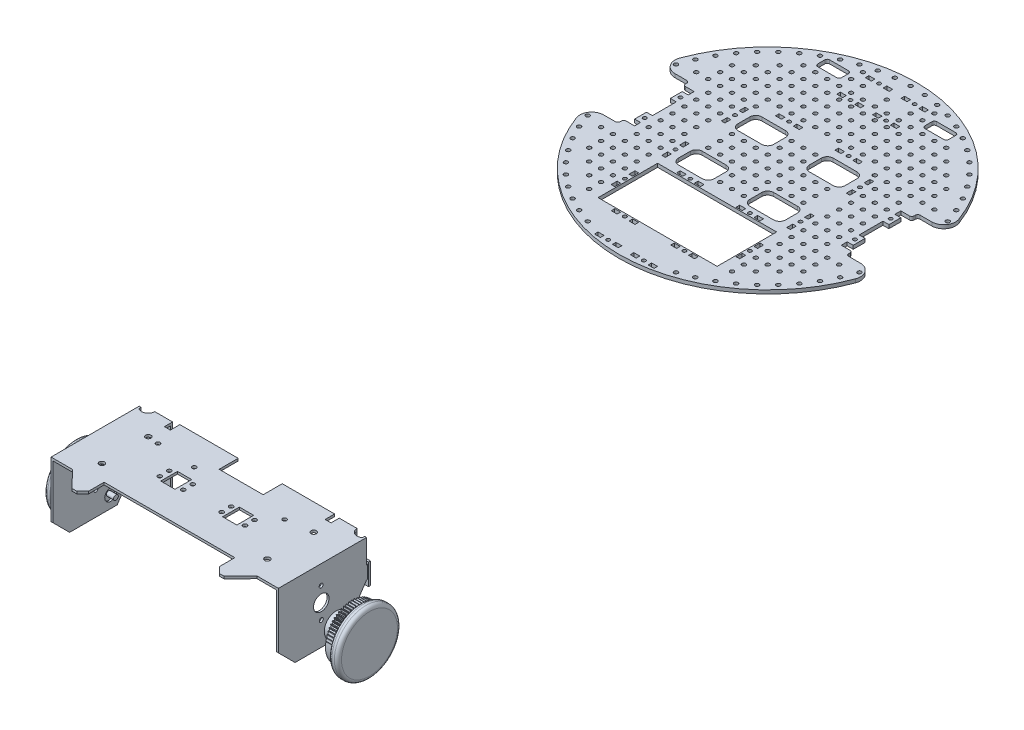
SolidWorks part; units mm, degrees
other "<Chassis_Cachan_Coupe_2019>-<Bloc_moteur_assemble-1/Chassis_Cachan-1-solid1>"
other "<Chassis_Cachan_Coupe_2019>-<Assemblage_roue-1/Roue-1-solid1>"
other "<Chassis_Cachan_Coupe_2019>-<Assemblage_roue-1/spur gear_iso-1-solid1>"
other "<Chassis_Cachan_Coupe_2019>-<Assemblage_roue-2/Roue-1-solid1>"
other "<Chassis_Cachan_Coupe_2019>-<Assemblage_roue-2/spur gear_iso-1-solid1>"
ref_plane "Plan de face" through (0, 0, 0) normal (0, 0, 1) x (1, 0, 0)
ref_plane "Plan de dessus" through (0, 0, 0) normal (0, 1, 0) x (1, 0, 0)
ref_plane "Plan de droite" through (0, 0, 0) normal (1, 0, 0) x (0, 0, -1)
inserted part "Chassis_Cachan_Coupe_2019"
sketch "Esquisse1" plane through (0, 7.9464, 0) normal (0, 1, 0) x (1, 0, 0)
  line L0 (-90, 0) -> (90, 0) construction
  line L1 (-96, -30) -> (-113.0885, -30)
  line L2 (-51, 41.5) -> (58.6644, 41.5) construction
  line L4 (-96, -25) -> (-96, -30)
  line L5 (88.3, 10) -> (88.3, 20) construction
  line L6 (86.8, -10) -> (91.8, -10)
  line L7 (86.8, 10) -> (86.8, 5)
  line L8 (-89.8, -25) -> (-96, -25)
  line L9 (91.8, -10) -> (91.8, -20)
  line L10 (86.8, 5) -> (89.8, 5) construction
  line L11 (86.8, 20) -> (86.8, 25)
  line L12 (-86.8, -25) -> (-89.8, -25)
  line L13 (91.8, -20) -> (86.8, -20)
  line L14 (-86.8, -20) -> (-86.8, -25)
  line L15 (88.3, 15) -> (81.3276, 15) construction
  line L16 (88.3, -20) -> (88.3, -10) construction
  line L17 (86.8, -20) -> (86.8, -25)
  line L18 (-91.8, -20) -> (-86.8, -20)
  line L19 (-91.8, -10) -> (-91.8, -20)
  line L20 (86.8, -25) -> (89.8, -25)
  line L21 (86.8, -10) -> (86.8, -5)
  line L22 (-86.8, -10) -> (-91.8, -10)
  line L23 (89.8, -25) -> (96, -25)
  line L24 (86.8, -5) -> (89.8, -5) construction
  line L25 (88.3, -15) -> (81.3276, -15) construction
  line L26 (96, -25) -> (96, -30)
  line L27 (86.8, 10) -> (91.8, 10)
  line L28 (91.8, 10) -> (91.8, 20)
  line L29 (91.8, 20) -> (86.8, 20)
  line L30 (96, 30) -> (113.0885, 30)
  line L31 (96, 30) -> (96, -30) construction
  line L32 (96, -30) -> (113.0885, -30)
  line L33 (113.0885, 30) -> (113.0885, -30) construction
  line L34 (-86.8, -10) -> (-86.8, -5)
  line L35 (-86.8, -5) -> (-86.8, 5)
  line L36 (-86.8, 10) -> (-86.8, 5)
  line L37 (-86.8, 10) -> (-91.8, 10)
  line L38 (86.8, 25) -> (96, 25)
  line L39 (86.8, -5) -> (86.8, 5)
  line L40 (96, 25) -> (96, 30)
  line L41 (-91.8, 10) -> (-91.8, 20)
  line L42 (-91.8, 20) -> (-86.8, 20)
  line L43 (-86.8, 20) -> (-86.8, 25)
  line L44 (-86.8, 25) -> (-96, 25)
  line L45 (-96, 25) -> (-96, 30)
  line L46 (-96, 30) -> (-113.0885, 30)
  line L59 (0, 0) -> (0, -125) construction
  line L82 (0, -93.5) -> (0, -41.5) construction
  line L83 (-51, -93.5) -> (51, -93.5) construction
  line L84 (-51, -93.5) -> (-51, -41.5) construction
  line L85 (-51, -41.5) -> (51, -41.5) construction
  line L86 (51, -93.5) -> (51, -41.5) construction
  line L87 (-51, -67.5) -> (51, -67.5) construction
  line L91 (-44.985, -93.5) -> (-35.015, -93.5) construction
  line L94 (-24.985, -93.5) -> (-15.015, -93.5) construction
  line L98 (-4.985, -93.5) -> (4.985, -93.5) construction
  line L102 (15.015, -93.5) -> (24.985, -93.5) construction
  line L106 (35.015, -93.5) -> (44.985, -93.5) construction
  line L108 (-51, -41.5) -> (51, -41.5) construction
  line L110 (35.015, -41.5) -> (44.985, -41.5) construction
  line L114 (15.015, -41.5) -> (24.985, -41.5) construction
  line L118 (-4.985, -41.5) -> (4.985, -41.5) construction
  line L122 (-24.985, -41.5) -> (-15.015, -41.5) construction
  line L125 (-44.985, -41.5) -> (-35.015, -41.5) construction
  line L129 (51, -93.5) -> (51, -41.5) construction
  line L131 (-51, -93.485) -> (-51, -83.515) construction
  line L135 (-51, -73.485) -> (-51, -63.515) construction
  line L139 (-51, -53.485) -> (-51, -43.515) construction
  line L144 (51, -53.485) -> (51, -43.515) construction
  line L148 (51, -73.485) -> (51, -63.515) construction
  line L152 (51, -93.485) -> (51, -83.515) construction
  line L154 (-51, -93.485) -> (-51, -93.5) construction
  line L155 (-51, -93.5) -> (-44.985, -93.5) construction
  line L156 (-35.015, -93.5) -> (-24.985, -93.5) construction
  line L157 (-15.015, -93.5) -> (-4.985, -93.5) construction
  line L158 (4.985, -93.5) -> (15.015, -93.5) construction
  line L159 (24.985, -93.5) -> (35.015, -93.5) construction
  line L160 (44.985, -93.5) -> (51, -93.5) construction
  line L161 (51, -93.5) -> (51, -93.485) construction
  line L162 (51, -83.515) -> (51, -73.485) construction
  line L163 (51, -63.515) -> (51, -53.485) construction
  line L164 (51, -43.515) -> (51, -41.5) construction
  line L165 (51, -41.5) -> (44.985, -41.5) construction
  line L166 (35.015, -41.5) -> (24.985, -41.5) construction
  line L167 (15.015, -41.5) -> (4.985, -41.5) construction
  line L168 (-4.985, -41.5) -> (-15.015, -41.5) construction
  line L169 (-24.985, -41.5) -> (-35.015, -41.5) construction
  line L170 (-44.985, -41.5) -> (-51, -41.5) construction
  line L171 (-51, -41.5) -> (-51, -43.515) construction
  line L172 (-51, -53.485) -> (-51, -63.515) construction
  line L173 (-51, -73.485) -> (-51, -83.515) construction
  line L174 (125.9773, 20) -> (118.7192, 20) construction
  line L181 (-27.8375, -117.5) -> (13.4826, -117.5) construction
  line L190 (-20, -96.2) -> (-20, -145.4677) construction
  line L191 (-40, -96.2) -> (-40, -138) construction
  line L253 (-50.9895, 107) -> (24.0329, 107) construction
  line L262 (-38.4384, 83) -> (36.5098, 83) construction
  circle A0 centre (0, 0) radius 125
  circle A1 centre (88.3, 15) radius 1.5
  circle A2 centre (88.3, -15) radius 1.5
  circle A3 centre (-88.3, -15) radius 1.5
  circle A4 centre (-88.3, 15) radius 1.5
  arc A5 (-113.0885, -30) -> (-113.0885, 30) centre (0, 0) cw
  arc A32 (113.0885, -30) -> (113.0885, 30) centre (0, 0) ccw
  point P115 (86.8, 0)
  line B0 (-54, 20) -> (-54, 15)
  line B1 (-54, 20) -> (-51, 20)
  line B2 (-51, 20) -> (-51, 15)
  line B3 (-54, 15) -> (-51, 15)
  line B4 (-54, 30) -> (-54, 35)
  line B5 (-54, 30) -> (-51, 30)
  line B6 (-51, 30) -> (-51, 35)
  line B7 (-54, 35) -> (-51, 35)
  line B8 (-52.5, 25) -> (-59.4724, 25) construction
  circle B9 centre (-52.5, 25) radius 1.5
  line B10 (-54, -30) -> (-54, -35)
  line B11 (-54, -30) -> (-51, -30)
  line B12 (-51, -30) -> (-51, -35)
  line B13 (-54, -35) -> (-51, -35)
  line B14 (-54, -20) -> (-54, -15)
  line B15 (-54, -20) -> (-51, -20)
  line B16 (-51, -20) -> (-51, -15)
  line B17 (-54, -15) -> (-51, -15)
  line B18 (-52.5, -25) -> (-59.4724, -25) construction
  circle B19 centre (-52.5, -25) radius 1.5
  line B20 (54, 30) -> (54, 35)
  line B21 (54, 30) -> (51, 30)
  line B22 (51, 30) -> (51, 35)
  line B23 (54, 35) -> (51, 35)
  line B24 (54, 20) -> (54, 15)
  line B25 (54, 20) -> (51, 20)
  line B26 (51, 20) -> (51, 15)
  line B27 (54, 15) -> (51, 15)
  line B28 (52.5, 25) -> (59.4724, 25) construction
  circle B29 centre (52.5, 25) radius 1.5
  line B30 (54, -20) -> (54, -15)
  line B31 (54, -20) -> (51, -20)
  line B32 (51, -20) -> (51, -15)
  line B33 (54, -15) -> (51, -15)
  line B34 (54, -30) -> (54, -35)
  line B35 (54, -30) -> (51, -30)
  line B36 (51, -30) -> (51, -35)
  line B37 (54, -35) -> (51, -35)
  line B38 (52.5, -25) -> (59.4724, -25) construction
  circle B39 centre (52.5, -25) radius 1.5
  line B40 (-30, 44.5) -> (-35, 44.5)
  line B41 (-30, 44.5) -> (-30, 41.5)
  line B42 (-30, 41.5) -> (-35, 41.5)
  line B43 (-35, 44.5) -> (-35, 41.5)
  line B44 (-20, 44.5) -> (-15, 44.5)
  line B45 (-20, 44.5) -> (-20, 41.5)
  line B46 (-20, 41.5) -> (-15, 41.5)
  line B47 (-15, 44.5) -> (-15, 41.5)
  line B48 (-25, 43) -> (-25, 49.9724) construction
  circle B49 centre (-25, 43) radius 1.5
  line B50 (20, 44.5) -> (15, 44.5)
  line B51 (20, 44.5) -> (20, 41.5)
  line B52 (20, 41.5) -> (15, 41.5)
  line B53 (15, 44.5) -> (15, 41.5)
  line B54 (30, 44.5) -> (35, 44.5)
  line B55 (30, 44.5) -> (30, 41.5)
  line B56 (30, 41.5) -> (35, 41.5)
  line B57 (35, 44.5) -> (35, 41.5)
  line B58 (25, 43) -> (25, 49.9724) construction
  circle B59 centre (25, 43) radius 1.5
  line B60 (-54, -72.5) -> (-54, -77.5)
  line B61 (-54, -72.5) -> (-51, -72.5)
  line B62 (-51, -72.5) -> (-51, -77.5)
  line B63 (-54, -77.5) -> (-51, -77.5)
  line B64 (-54, -62.5) -> (-54, -57.5)
  line B65 (-54, -62.5) -> (-51, -62.5)
  line B66 (-51, -62.5) -> (-51, -57.5)
  line B67 (-54, -57.5) -> (-51, -57.5)
  line B68 (-52.5, -67.5) -> (-59.4724, -67.5) construction
  circle B69 centre (-52.5, -67.5) radius 1.5
  line B70 (20, -38.5) -> (15, -38.5)
  line B71 (20, -38.5) -> (20, -41.5)
  line B72 (20, -41.5) -> (15, -41.5)
  line B73 (15, -38.5) -> (15, -41.5)
  line B74 (30, -38.5) -> (35, -38.5)
  line B75 (30, -38.5) -> (30, -41.5)
  line B76 (30, -41.5) -> (35, -41.5)
  line B77 (35, -38.5) -> (35, -41.5)
  line B78 (25, -40) -> (25, -33.0276) construction
  circle B79 centre (25, -40) radius 1.5
  line B80 (-30, -38.5) -> (-35, -38.5)
  line B81 (-30, -38.5) -> (-30, -41.5)
  line B82 (-30, -41.5) -> (-35, -41.5)
  line B83 (-35, -38.5) -> (-35, -41.5)
  line B84 (-20, -38.5) -> (-15, -38.5)
  line B85 (-20, -38.5) -> (-20, -41.5)
  line B86 (-20, -41.5) -> (-15, -41.5)
  line B87 (-15, -38.5) -> (-15, -41.5)
  circle B88 centre (-25, -40) radius 1.5
  line B89 (-30, -93.5) -> (-35, -93.5)
  line B90 (-30, -93.5) -> (-30, -96.5)
  line B91 (-30, -96.5) -> (-35, -96.5)
  line B92 (-35, -93.5) -> (-35, -96.5)
  line B93 (-20, -93.5) -> (-15, -93.5)
  line B94 (-20, -93.5) -> (-20, -96.5)
  line B95 (-20, -96.5) -> (-15, -96.5)
  line B96 (-15, -93.5) -> (-15, -96.5)
  circle B97 centre (-25, -95) radius 1.5
  line B98 (20, -93.5) -> (15, -93.5)
  line B99 (20, -93.5) -> (20, -96.5)
  line B100 (20, -96.5) -> (15, -96.5)
  line B101 (15, -93.5) -> (15, -96.5)
  line B102 (30, -93.5) -> (35, -93.5)
  line B103 (30, -93.5) -> (30, -96.5)
  line B104 (30, -96.5) -> (35, -96.5)
  line B105 (35, -93.5) -> (35, -96.5)
  line B106 (25, -95) -> (25, -88.0276) construction
  circle B107 centre (25, -95) radius 1.5
  line B108 (54, -62.5) -> (54, -57.5)
  line B109 (54, -62.5) -> (51, -62.5)
  line B110 (51, -62.5) -> (51, -57.5)
  line B111 (54, -57.5) -> (51, -57.5)
  line B112 (54, -72.5) -> (54, -77.5)
  line B113 (54, -72.5) -> (51, -72.5)
  line B114 (51, -72.5) -> (51, -77.5)
  line B115 (54, -77.5) -> (51, -77.5)
  line B116 (52.5, -67.5) -> (59.4724, -67.5) construction
  circle B117 centre (52.5, -67.5) radius 1.5
  line B118 (10, -117.5) -> (5, -117.5)
  line B119 (10, -117.5) -> (10, -120.5)
  line B120 (10, -120.5) -> (5, -120.5)
  line B121 (5, -117.5) -> (5, -120.5)
  line B122 (20, -117.5) -> (25, -117.5)
  line B123 (20, -117.5) -> (20, -120.5)
  line B124 (20, -120.5) -> (25, -120.5)
  line B125 (25, -117.5) -> (25, -120.5)
  line B126 (15, -119) -> (15, -112.0276) construction
  circle B127 centre (15, -119) radius 1.5
  line B128 (-20, -117.5) -> (-25, -117.5)
  line B129 (-20, -117.5) -> (-20, -120.5)
  line B130 (-20, -120.5) -> (-25, -120.5)
  line B131 (-25, -117.5) -> (-25, -120.5)
  line B132 (-10, -117.5) -> (-5, -117.5)
  line B133 (-10, -117.5) -> (-10, -120.5)
  line B134 (-10, -120.5) -> (-5, -120.5)
  line B135 (-5, -117.5) -> (-5, -120.5)
  line B136 (-15, -119) -> (-15, -112.0276) construction
  circle B137 centre (-15, -119) radius 1.5
  line B138 (-20, 86) -> (-25, 86)
  line B139 (-20, 86) -> (-20, 83)
  line B140 (-20, 83) -> (-25, 83)
  line B141 (-25, 86) -> (-25, 83)
  line B142 (-10, 86) -> (-5, 86)
  line B143 (-10, 86) -> (-10, 83)
  line B144 (-10, 83) -> (-5, 83)
  line B145 (-5, 86) -> (-5, 83)
  line B146 (-15, 84.5) -> (-15, 91.4724) construction
  circle B147 centre (-15, 84.5) radius 1.5
  line B148 (10, 86) -> (5, 86)
  line B149 (10, 86) -> (10, 83)
  line B150 (10, 83) -> (5, 83)
  line B151 (5, 86) -> (5, 83)
  line B152 (20, 86) -> (25, 86)
  line B153 (20, 86) -> (20, 83)
  line B154 (20, 83) -> (25, 83)
  line B155 (25, 86) -> (25, 83)
  line B156 (15, 84.5) -> (15, 91.4724) construction
  circle B157 centre (15, 84.5) radius 1.5
  line B158 (10, 110) -> (5, 110)
  line B159 (10, 110) -> (10, 107)
  line B160 (10, 107) -> (5, 107)
  line B161 (5, 110) -> (5, 107)
  line B162 (20, 110) -> (25, 110)
  line B163 (20, 110) -> (20, 107)
  line B164 (20, 107) -> (25, 107)
  line B165 (25, 110) -> (25, 107)
  line B166 (15, 108.5) -> (15, 115.4724) construction
  circle B167 centre (15, 108.5) radius 1.5
  line B168 (-20, 110) -> (-25, 110)
  line B169 (-20, 110) -> (-20, 107)
  line B170 (-20, 107) -> (-25, 107)
  line B171 (-25, 110) -> (-25, 107)
  line B172 (-10, 110) -> (-5, 110)
  line B173 (-10, 110) -> (-10, 107)
  line B174 (-10, 107) -> (-5, 107)
  line B175 (-5, 110) -> (-5, 107)
  line B176 (-15, 108.5) -> (-15, 115.4724) construction
  circle B177 centre (-15, 108.5) radius 1.5
  dimension "D4" = 96
  dimension "D8" = 8
  dimension "D21" = 250
  dimension "D5" = 60
  dimension "D23" = 3
  dimension "D28" = 3
  dimension "D6" = 80
  dimension "D7" = 15
  dimension "D9" = 26
  dimension "D10" = 15
  dimension "D11" = 9.2
  dimension "D13" = 10
  dimension "D12" = 20
  dimension "D14" = 102
  dimension "D15" = 52
  dimension "D16" = 10
  dimension "D17" = 50
  dimension "D18" = 15
  dimension "D19" = 5
  dimension "D20" = 20
  dimension "D22" = 3
  dimension "D24" = 24
  dimension "D25" = 5
  dimension "D26" = 1.5
  dimension "D27" = 3
  dimension "D29" = 20
  dimension "D30" = 1.5
  dimension "D31" = 5
  dimension "D32" = 83
  dimension "D33" = 30
  dimension "D34" = 5
  dimension "D35" = 24
  dimension "D36" = 30
  dimension "D37" = 25
  dimension "D38" = 30
  dimension "D39" = 25
sketch_block_instance "Insert M3 avec plot 3mm coté trou-1"
sketch_block "Insert M3 avec plot 3mm coté trou" parameters "D2"=3, "D1"=3, "D3"=5, "D4"=10
sketch_block_instance "Insert M3 avec plot 3mm coté trou-2"
sketch_block_instance "Insert M3 avec plot 3mm coté trou-4"
sketch_block_instance "Insert M3 avec plot 3mm coté trou-5"
sketch_block_instance "Insert M3 avec plot 3mm coté trou-10"
sketch_block_instance "Insert M3 avec plot 3mm coté trou-11"
sketch_block_instance "Insert M3 avec plot 3mm coté trou-15"
sketch_block_instance "Insert M3 avec plot 3mm coté trou-18"
sketch_block_instance "Insert M3 avec plot 3mm coté trou-20"
sketch_block_instance "Insert M3 avec plot 3mm coté trou-21"
sketch_block_instance "Insert M3 avec plot 3mm coté trou-23"
sketch_block_instance "Insert M3 avec plot 3mm coté trou-27"
sketch_block_instance "Insert M3 avec plot 3mm coté trou-29"
sketch_block_instance "Insert M3 avec plot 3mm coté trou-30"
sketch_block_instance "Insert M3 avec plot 3mm coté trou-31"
sketch_block_instance "Insert M3 avec plot 3mm coté trou-32"
sketch_block_instance "Insert M3 avec plot 3mm coté trou-33"
sketch_block_instance "Insert M3 avec plot 3mm coté trou-34"
extrude "Boss.-Extru.1" add sketch "Esquisse1" along normal blind 3 separate body
sketch "Esquisse2" plane through (0, 10.9464, 0) normal (0, 1, 0) x (1, 0, 0)
  line L0 (-125, 0) -> (125, 0) construction
  line L1 (0, -125) -> (0, 125) construction
  line L2 (-45, -35) -> (-45, -15)
  line L3 (-45, 35) -> (-15, 35)
  line L6 (-50, -42.5) -> (50, -42.5)
  line L7 (-50, -42.5) -> (-50, -92.5)
  line L8 (-50, -92.5) -> (50, -92.5)
  line L10 (50, -42.5) -> (50, -92.5)
  line L14 (-45, 35) -> (-45, 15)
  line L15 (-45, 15) -> (-15, 15)
  line L16 (-15, 35) -> (-15, 15)
  line L17 (-45, -15) -> (-15, -15)
  line L18 (-15, -35) -> (-15, -15)
  line L19 (-45, -35) -> (-15, -35)
  line L20 (45, -35) -> (45, -15)
  line L21 (45, -35) -> (15, -35)
  line L22 (15, -35) -> (15, -15)
  line L23 (45, -15) -> (15, -15)
  line L24 (45, 35) -> (45, 15)
  line L25 (45, 15) -> (15, 15)
  line L26 (15, 35) -> (15, 15)
  line L27 (45, 35) -> (15, 35)
  line L28 (55, 105) -> (55, 95)
  line L29 (-55, 105) -> (-35, 105)
  line L30 (-55, 105) -> (-55, 95)
  line L31 (-55, 95) -> (-35, 95)
  line L32 (-35, 105) -> (-35, 95)
  line L33 (55, 95) -> (35, 95)
  line L34 (35, 105) -> (35, 95)
  line L35 (55, 105) -> (35, 105)
  line L36 (-20, -41.5) -> (-15, -41.5) construction
  line L38 (51, -57.5) -> (51, -62.5) construction
  line L39 (35, -93.5) -> (30, -93.5) construction
  line L40 (-51, -77.5) -> (-51, -72.5) construction
  circle A0 centre (0, 0) radius 1.65
  circle A2 centre (10, 0) radius 1.65
  circle A3 centre (20, 0) radius 1.65
  circle A4 centre (30, 0) radius 1.65
  circle A5 centre (40, 0) radius 1.65
  circle A6 centre (50, 0) radius 1.65 construction
  circle A7 centre (60, 0) radius 1.65
  circle A8 centre (70, 0) radius 1.65
  circle A9 centre (80, 0) radius 1.65
  circle A10 centre (90, 0) radius 1.65 construction
  circle A11 centre (100, 0) radius 1.65 construction
  circle A12 centre (110, 0) radius 1.65 construction
  circle A13 centre (120, 0) radius 1.65 construction
  circle A14 centre (10, 10) radius 1.65
  circle A15 centre (20, 10) radius 1.65
  circle A16 centre (30, 10) radius 1.65
  circle A17 centre (40, 10) radius 1.65
  circle A18 centre (50, 10) radius 1.65 construction
  circle A19 centre (60, 10) radius 1.65
  circle A20 centre (70, 10) radius 1.65
  circle A21 centre (80, 10) radius 1.65
  circle A22 centre (90, 10) radius 1.65 construction
  circle A23 centre (100, 10) radius 1.65 construction
  circle A24 centre (110, 10) radius 1.65 construction
  circle A25 centre (120, 10) radius 1.65 construction
  circle A26 centre (10, 20) radius 1.65
  circle A27 centre (20, 20) radius 1.65 construction
  circle A28 centre (30, 20) radius 1.65 construction
  circle A29 centre (40, 20) radius 1.65 construction
  circle A30 centre (50, 20) radius 1.65 construction
  circle A31 centre (60, 20) radius 1.65
  circle A32 centre (70, 20) radius 1.65
  circle A33 centre (80, 20) radius 1.65
  circle A34 centre (90, 20) radius 1.65 construction
  circle A35 centre (100, 20) radius 1.65 construction
  circle A36 centre (110, 20) radius 1.65 construction
  circle A37 centre (120, 20) radius 1.65 construction
  circle A38 centre (10, 30) radius 1.65
  circle A39 centre (20, 30) radius 1.65 construction
  circle A40 centre (30, 30) radius 1.65 construction
  circle A41 centre (40, 30) radius 1.65 construction
  circle A42 centre (50, 30) radius 1.65 construction
  circle A43 centre (60, 30) radius 1.65
  circle A44 centre (70, 30) radius 1.65
  circle A45 centre (80, 30) radius 1.65
  circle A46 centre (90, 30) radius 1.65 construction
  circle A47 centre (100, 30) radius 1.65 construction
  circle A48 centre (110, 30) radius 1.65 construction
  circle A49 centre (120, 30) radius 1.65 construction
  circle A50 centre (10, 40) radius 1.65 construction
  circle A51 centre (20, 40) radius 1.65 construction
  circle A52 centre (30, 40) radius 1.65 construction
  circle A53 centre (40, 40) radius 1.65 construction
  circle A54 centre (50, 40) radius 1.65
  circle A55 centre (60, 40) radius 1.65
  circle A56 centre (70, 40) radius 1.65
  circle A57 centre (80, 40) radius 1.65
  circle A58 centre (90, 40) radius 1.65
  circle A59 centre (100, 40) radius 1.65
  circle A60 centre (110, 40) radius 1.65 construction
  circle A61 centre (120, 40) radius 1.65 construction
  circle A62 centre (10, 50) radius 1.65
  circle A63 centre (20, 50) radius 1.65
  circle A64 centre (30, 50) radius 1.65
  circle A65 centre (40, 50) radius 1.65
  circle A66 centre (50, 50) radius 1.65
  circle A67 centre (60, 50) radius 1.65
  circle A68 centre (70, 50) radius 1.65
  circle A69 centre (80, 50) radius 1.65
  circle A70 centre (90, 50) radius 1.65
  circle A71 centre (100, 50) radius 1.65 construction
  circle A72 centre (110, 50) radius 1.65 construction
  circle A73 centre (120, 50) radius 1.65 construction
  circle A74 centre (10, 60) radius 1.65
  circle A75 centre (20, 60) radius 1.65
  circle A76 centre (30, 60) radius 1.65
  circle A77 centre (40, 60) radius 1.65
  circle A78 centre (50, 60) radius 1.65
  circle A79 centre (60, 60) radius 1.65
  circle A80 centre (70, 60) radius 1.65
  circle A81 centre (80, 60) radius 1.65
  circle A82 centre (90, 60) radius 1.65
  circle A83 centre (100, 60) radius 1.65 construction
  circle A84 centre (110, 60) radius 1.65 construction
  circle A85 centre (120, 60) radius 1.65 construction
  circle A86 centre (10, 70) radius 1.65
  circle A87 centre (20, 70) radius 1.65
  circle A88 centre (30, 70) radius 1.65
  circle A89 centre (40, 70) radius 1.65
  circle A90 centre (50, 70) radius 1.65
  circle A91 centre (60, 70) radius 1.65
  circle A92 centre (70, 70) radius 1.65
  circle A93 centre (80, 70) radius 1.65
  circle A94 centre (90, 70) radius 1.65 construction
  circle A95 centre (100, 70) radius 1.65 construction
  circle A96 centre (110, 70) radius 1.65 construction
  circle A97 centre (120, 70) radius 1.65 construction
  circle A98 centre (10, 80) radius 1.65
  circle A99 centre (20, 80) radius 1.65
  circle A100 centre (30, 80) radius 1.65
  circle A101 centre (40, 80) radius 1.65
  circle A102 centre (50, 80) radius 1.65
  circle A103 centre (60, 80) radius 1.65
  circle A104 centre (70, 80) radius 1.65
  circle A105 centre (80, 80) radius 1.65 construction
  circle A106 centre (90, 80) radius 1.65 construction
  circle A107 centre (100, 80) radius 1.65 construction
  circle A108 centre (110, 80) radius 1.65 construction
  circle A109 centre (120, 80) radius 1.65 construction
  circle A110 centre (10, 90) radius 1.65
  circle A111 centre (20, 90) radius 1.65
  circle A112 centre (30, 90) radius 1.65
  circle A113 centre (40, 90) radius 1.65
  circle A114 centre (50, 90) radius 1.65
  circle A115 centre (60, 90) radius 1.65
  circle A116 centre (70, 90) radius 1.65 construction
  circle A117 centre (80, 90) radius 1.65 construction
  circle A118 centre (90, 90) radius 1.65 construction
  circle A119 centre (100, 90) radius 1.65 construction
  circle A120 centre (110, 90) radius 1.65 construction
  circle A121 centre (120, 90) radius 1.65 construction
  circle A122 centre (10, 100) radius 1.65 construction
  circle A123 centre (20, 100) radius 1.65
  circle A124 centre (30, 100) radius 1.65
  circle A125 centre (40, 100) radius 1.65 construction
  circle A126 centre (50, 100) radius 1.65 construction
  circle A127 centre (60, 100) radius 1.65 construction
  circle A128 centre (70, 100) radius 1.65 construction
  circle A129 centre (80, 100) radius 1.65 construction
  circle A130 centre (90, 100) radius 1.65 construction
  circle A131 centre (100, 100) radius 1.65 construction
  circle A132 centre (110, 100) radius 1.65 construction
  circle A133 centre (120, 100) radius 1.65 construction
  circle A134 centre (10, 110) radius 1.65 construction
  circle A135 centre (20, 110) radius 1.65 construction
  circle A136 centre (30, 110) radius 1.65
  circle A137 centre (40, 110) radius 1.65 construction
  circle A138 centre (50, 110) radius 1.65 construction
  circle A139 centre (60, 110) radius 1.65 construction
  circle A140 centre (70, 110) radius 1.65 construction
  circle A141 centre (80, 110) radius 1.65 construction
  circle A142 centre (90, 110) radius 1.65 construction
  circle A143 centre (100, 110) radius 1.65 construction
  circle A144 centre (110, 110) radius 1.65 construction
  circle A145 centre (120, 110) radius 1.65 construction
  circle A146 centre (10, 120) radius 1.65 construction
  circle A147 centre (20, 120) radius 1.65 construction
  circle A148 centre (30, 120) radius 1.65 construction
  circle A149 centre (40, 120) radius 1.65 construction
  circle A150 centre (50, 120) radius 1.65 construction
  circle A151 centre (60, 120) radius 1.65 construction
  circle A152 centre (70, 120) radius 1.65 construction
  circle A153 centre (80, 120) radius 1.65 construction
  circle A154 centre (90, 120) radius 1.65 construction
  circle A155 centre (100, 120) radius 1.65 construction
  circle A156 centre (110, 120) radius 1.65 construction
  circle A157 centre (120, 120) radius 1.65 construction
  circle A158 centre (0, 10) radius 1.65
  circle A159 centre (0, 20) radius 1.65
  circle A160 centre (0, 30) radius 1.65
  circle A161 centre (0, 40) radius 1.65 construction
  circle A162 centre (0, 50) radius 1.65
  circle A163 centre (0, 60) radius 1.65
  circle A164 centre (0, 70) radius 1.65
  circle A165 centre (0, 80) radius 1.65
  circle A166 centre (0, 90) radius 1.65
  circle A167 centre (0, 100) radius 1.65
  circle A168 centre (0, 110) radius 1.65 construction
  circle A169 centre (0, 120) radius 1.65
  circle A170 centre (-120, 120) radius 1.65 construction
  circle A171 centre (-110, 120) radius 1.65 construction
  circle A172 centre (-100, 120) radius 1.65 construction
  circle A173 centre (-90, 120) radius 1.65 construction
  circle A174 centre (-80, 120) radius 1.65 construction
  circle A175 centre (-70, 120) radius 1.65 construction
  circle A176 centre (-60, 120) radius 1.65 construction
  circle A177 centre (-50, 120) radius 1.65 construction
  circle A178 centre (-40, 120) radius 1.65 construction
  circle A179 centre (-30, 120) radius 1.65 construction
  circle A180 centre (-20, 120) radius 1.65 construction
  circle A181 centre (-10, 120) radius 1.65 construction
  circle A182 centre (-120, 110) radius 1.65 construction
  circle A183 centre (-110, 110) radius 1.65 construction
  circle A184 centre (-100, 110) radius 1.65 construction
  circle A185 centre (-90, 110) radius 1.65 construction
  circle A186 centre (-80, 110) radius 1.65 construction
  circle A187 centre (-70, 110) radius 1.65 construction
  circle A188 centre (-60, 110) radius 1.65 construction
  circle A189 centre (-50, 110) radius 1.65 construction
  circle A190 centre (-40, 110) radius 1.65 construction
  circle A191 centre (-120, 100) radius 1.65 construction
  circle A192 centre (-110, 100) radius 1.65 construction
  circle A193 centre (-100, 100) radius 1.65 construction
  circle A194 centre (-90, 100) radius 1.65 construction
  circle A195 centre (-80, 100) radius 1.65 construction
  circle A196 centre (-70, 100) radius 1.65 construction
  circle A197 centre (-60, 100) radius 1.65 construction
  circle A198 centre (-120, 90) radius 1.65 construction
  circle A199 centre (-110, 90) radius 1.65 construction
  circle A200 centre (-100, 90) radius 1.65 construction
  circle A201 centre (-90, 90) radius 1.65 construction
  circle A202 centre (-80, 90) radius 1.65 construction
  circle A203 centre (-70, 90) radius 1.65 construction
  circle A204 centre (-120, 80) radius 1.65 construction
  circle A205 centre (-110, 80) radius 1.65 construction
  circle A206 centre (-100, 80) radius 1.65 construction
  circle A207 centre (-90, 80) radius 1.65 construction
  circle A208 centre (-80, 80) radius 1.65 construction
  circle A209 centre (-120, 70) radius 1.65 construction
  circle A210 centre (-110, 70) radius 1.65 construction
  circle A211 centre (-100, 70) radius 1.65 construction
  circle A212 centre (-90, 70) radius 1.65 construction
  circle A213 centre (-120, 60) radius 1.65 construction
  circle A214 centre (-110, 60) radius 1.65 construction
  circle A215 centre (-100, 60) radius 1.65 construction
  circle A216 centre (-120, 50) radius 1.65 construction
  circle A217 centre (-110, 50) radius 1.65 construction
  circle A218 centre (-100, 50) radius 1.65 construction
  circle A219 centre (-120, 40) radius 1.65 construction
  circle A220 centre (-110, 40) radius 1.65 construction
  circle A221 centre (-50, 40) radius 1.65
  circle A222 centre (-120, 30) radius 1.65 construction
  circle A223 centre (-110, 30) radius 1.65 construction
  circle A224 centre (-100, 30) radius 1.65 construction
  circle A225 centre (-90, 30) radius 1.65 construction
  circle A226 centre (-50, 30) radius 1.65 construction
  circle A227 centre (-120, 20) radius 1.65 construction
  circle A228 centre (-110, 20) radius 1.65 construction
  circle A229 centre (-100, 20) radius 1.65 construction
  circle A230 centre (-90, 20) radius 1.65 construction
  circle A231 centre (-50, 20) radius 1.65 construction
  circle A232 centre (-120, 10) radius 1.65 construction
  circle A233 centre (-110, 10) radius 1.65 construction
  circle A234 centre (-100, 10) radius 1.65 construction
  circle A235 centre (-90, 10) radius 1.65 construction
  circle A236 centre (-50, 10) radius 1.65 construction
  circle A237 centre (-120, 0) radius 1.65 construction
  circle A238 centre (-110, 0) radius 1.65 construction
  circle A239 centre (-100, 0) radius 1.65 construction
  circle A240 centre (-90, 0) radius 1.65 construction
  circle A241 centre (-50, 0) radius 1.65 construction
  circle A242 centre (-30, 110) radius 1.65
  circle A243 centre (-20, 110) radius 1.65 construction
  circle A244 centre (-10, 110) radius 1.65 construction
  circle A245 centre (-50, 100) radius 1.65 construction
  circle A246 centre (-40, 100) radius 1.65 construction
  circle A247 centre (-30, 100) radius 1.65
  circle A248 centre (-20, 100) radius 1.65
  circle A249 centre (-10, 100) radius 1.65 construction
  circle A250 centre (-60, 90) radius 1.65
  circle A251 centre (-50, 90) radius 1.65
  circle A252 centre (-40, 90) radius 1.65
  circle A253 centre (-30, 90) radius 1.65
  circle A254 centre (-20, 90) radius 1.65
  circle A255 centre (-10, 90) radius 1.65
  circle A256 centre (-70, 80) radius 1.65
  circle A257 centre (-60, 80) radius 1.65
  circle A258 centre (-50, 80) radius 1.65
  circle A259 centre (-40, 80) radius 1.65
  circle A260 centre (-30, 80) radius 1.65
  circle A261 centre (-20, 80) radius 1.65
  circle A262 centre (-10, 80) radius 1.65
  circle A263 centre (-80, 70) radius 1.65
  circle A264 centre (-70, 70) radius 1.65
  circle A265 centre (-60, 70) radius 1.65
  circle A266 centre (-50, 70) radius 1.65
  circle A267 centre (-40, 70) radius 1.65
  circle A268 centre (-30, 70) radius 1.65
  circle A269 centre (-20, 70) radius 1.65
  circle A270 centre (-10, 70) radius 1.65
  circle A271 centre (-90, 60) radius 1.65
  circle A272 centre (-80, 60) radius 1.65
  circle A273 centre (-70, 60) radius 1.65
  circle A274 centre (-60, 60) radius 1.65
  circle A275 centre (-50, 60) radius 1.65
  circle A276 centre (-40, 60) radius 1.65
  circle A277 centre (-30, 60) radius 1.65
  circle A278 centre (-20, 60) radius 1.65
  circle A279 centre (-10, 60) radius 1.65
  circle A280 centre (-90, 50) radius 1.65
  circle A281 centre (-80, 50) radius 1.65
  circle A282 centre (-70, 50) radius 1.65
  circle A283 centre (-60, 50) radius 1.65
  circle A284 centre (-50, 50) radius 1.65
  circle A285 centre (-40, 50) radius 1.65
  circle A286 centre (-30, 50) radius 1.65
  circle A287 centre (-20, 50) radius 1.65
  circle A288 centre (-10, 50) radius 1.65
  circle A289 centre (-100, 40) radius 1.65
  circle A290 centre (-90, 40) radius 1.65
  circle A291 centre (-80, 40) radius 1.65
  circle A292 centre (-70, 40) radius 1.65
  circle A293 centre (-60, 40) radius 1.65
  circle A294 centre (-40, 40) radius 1.65 construction
  circle A295 centre (-30, 40) radius 1.65 construction
  circle A296 centre (-20, 40) radius 1.65 construction
  circle A297 centre (-10, 40) radius 1.65 construction
  circle A298 centre (-80, 30) radius 1.65
  circle A299 centre (-70, 30) radius 1.65
  circle A300 centre (-60, 30) radius 1.65
  circle A301 centre (-40, 30) radius 1.65 construction
  circle A302 centre (-30, 30) radius 1.65 construction
  circle A303 centre (-20, 30) radius 1.65 construction
  circle A304 centre (-10, 30) radius 1.65
  circle A305 centre (-80, 20) radius 1.65
  circle A306 centre (-70, 20) radius 1.65
  circle A307 centre (-60, 20) radius 1.65
  circle A308 centre (-40, 20) radius 1.65 construction
  circle A309 centre (-30, 20) radius 1.65 construction
  circle A310 centre (-20, 20) radius 1.65 construction
  circle A311 centre (-10, 20) radius 1.65
  circle A312 centre (-80, 10) radius 1.65
  circle A313 centre (-70, 10) radius 1.65
  circle A314 centre (-60, 10) radius 1.65
  circle A315 centre (-40, 10) radius 1.65
  circle A316 centre (-30, 10) radius 1.65
  circle A317 centre (-20, 10) radius 1.65
  circle A318 centre (-10, 10) radius 1.65
  circle A319 centre (-80, 0) radius 1.65
  circle A320 centre (-70, 0) radius 1.65
  circle A321 centre (-60, 0) radius 1.65
  circle A322 centre (-40, 0) radius 1.65
  circle A323 centre (-30, 0) radius 1.65
  circle A324 centre (-20, 0) radius 1.65
  circle A325 centre (-10, 0) radius 1.65
  circle A326 centre (-50, -10) radius 1.65 construction
  circle A327 centre (-90, -10) radius 1.65 construction
  circle A328 centre (-100, -10) radius 1.65 construction
  circle A329 centre (-110, -10) radius 1.65 construction
  circle A330 centre (-120, -10) radius 1.65 construction
  circle A331 centre (-50, -20) radius 1.65 construction
  circle A332 centre (-90, -20) radius 1.65 construction
  circle A333 centre (-100, -20) radius 1.65 construction
  circle A334 centre (-110, -20) radius 1.65 construction
  circle A335 centre (-120, -20) radius 1.65 construction
  circle A336 centre (-50, -30) radius 1.65 construction
  circle A337 centre (-90, -30) radius 1.65 construction
  circle A338 centre (-100, -30) radius 1.65 construction
  circle A339 centre (-110, -30) radius 1.65 construction
  circle A340 centre (-120, -30) radius 1.65 construction
  circle A341 centre (-50, -40) radius 1.65 construction
  circle A342 centre (-110, -40) radius 1.65 construction
  circle A343 centre (-120, -40) radius 1.65 construction
  circle A344 centre (-100, -50) radius 1.65 construction
  circle A345 centre (-110, -50) radius 1.65 construction
  circle A346 centre (-120, -50) radius 1.65 construction
  circle A347 centre (-100, -60) radius 1.65 construction
  circle A348 centre (-110, -60) radius 1.65 construction
  circle A349 centre (-120, -60) radius 1.65 construction
  circle A350 centre (-90, -70) radius 1.65 construction
  circle A351 centre (-100, -70) radius 1.65 construction
  circle A352 centre (-110, -70) radius 1.65 construction
  circle A353 centre (-120, -70) radius 1.65 construction
  circle A354 centre (-80, -80) radius 1.65 construction
  circle A355 centre (-90, -80) radius 1.65 construction
  circle A356 centre (-100, -80) radius 1.65 construction
  circle A357 centre (-110, -80) radius 1.65 construction
  circle A358 centre (-120, -80) radius 1.65 construction
  circle A359 centre (-70, -90) radius 1.65 construction
  circle A360 centre (-80, -90) radius 1.65 construction
  circle A361 centre (-90, -90) radius 1.65 construction
  circle A362 centre (-100, -90) radius 1.65 construction
  circle A363 centre (-110, -90) radius 1.65 construction
  circle A364 centre (-120, -90) radius 1.65 construction
  circle A365 centre (-60, -100) radius 1.65 construction
  circle A366 centre (-70, -100) radius 1.65 construction
  circle A367 centre (-80, -100) radius 1.65 construction
  circle A368 centre (-90, -100) radius 1.65 construction
  circle A369 centre (-100, -100) radius 1.65 construction
  circle A370 centre (-110, -100) radius 1.65 construction
  circle A371 centre (-120, -100) radius 1.65 construction
  circle A372 centre (-40, -110) radius 1.65 construction
  circle A373 centre (-50, -110) radius 1.65 construction
  circle A374 centre (-60, -110) radius 1.65 construction
  circle A375 centre (-70, -110) radius 1.65 construction
  circle A376 centre (-80, -110) radius 1.65 construction
  circle A377 centre (-90, -110) radius 1.65 construction
  circle A378 centre (-100, -110) radius 1.65 construction
  circle A379 centre (-110, -110) radius 1.65 construction
  circle A380 centre (-120, -110) radius 1.65 construction
  circle A381 centre (-10, -120) radius 1.65 construction
  circle A382 centre (-20, -120) radius 1.65 construction
  circle A383 centre (-30, -120) radius 1.65 construction
  circle A384 centre (-40, -120) radius 1.65 construction
  circle A385 centre (-50, -120) radius 1.65 construction
  circle A386 centre (-60, -120) radius 1.65 construction
  circle A387 centre (-70, -120) radius 1.65 construction
  circle A388 centre (-80, -120) radius 1.65 construction
  circle A389 centre (-90, -120) radius 1.65 construction
  circle A390 centre (-100, -120) radius 1.65 construction
  circle A391 centre (-110, -120) radius 1.65 construction
  circle A392 centre (-120, -120) radius 1.65 construction
  circle A393 centre (0, -120) radius 1.65 construction
  circle A394 centre (120, -120) radius 1.65 construction
  circle A395 centre (110, -120) radius 1.65 construction
  circle A396 centre (100, -120) radius 1.65 construction
  circle A397 centre (90, -120) radius 1.65 construction
  circle A398 centre (80, -120) radius 1.65 construction
  circle A399 centre (70, -120) radius 1.65 construction
  circle A400 centre (60, -120) radius 1.65 construction
  circle A401 centre (50, -120) radius 1.65 construction
  circle A402 centre (40, -120) radius 1.65 construction
  circle A403 centre (30, -120) radius 1.65 construction
  circle A404 centre (20, -120) radius 1.65 construction
  circle A405 centre (10, -120) radius 1.65 construction
  circle A406 centre (120, -110) radius 1.65 construction
  circle A407 centre (110, -110) radius 1.65 construction
  circle A408 centre (100, -110) radius 1.65 construction
  circle A409 centre (90, -110) radius 1.65 construction
  circle A410 centre (80, -110) radius 1.65 construction
  circle A411 centre (70, -110) radius 1.65 construction
  circle A412 centre (60, -110) radius 1.65 construction
  circle A413 centre (50, -110) radius 1.65 construction
  circle A414 centre (40, -110) radius 1.65 construction
  circle A415 centre (120, -100) radius 1.65 construction
  circle A416 centre (110, -100) radius 1.65 construction
  circle A417 centre (100, -100) radius 1.65 construction
  circle A418 centre (90, -100) radius 1.65 construction
  circle A419 centre (80, -100) radius 1.65 construction
  circle A420 centre (70, -100) radius 1.65 construction
  circle A421 centre (60, -100) radius 1.65 construction
  circle A422 centre (120, -90) radius 1.65 construction
  circle A423 centre (110, -90) radius 1.65 construction
  circle A424 centre (100, -90) radius 1.65 construction
  circle A425 centre (90, -90) radius 1.65 construction
  circle A426 centre (80, -90) radius 1.65 construction
  circle A427 centre (70, -90) radius 1.65 construction
  circle A428 centre (120, -80) radius 1.65 construction
  circle A429 centre (110, -80) radius 1.65 construction
  circle A430 centre (100, -80) radius 1.65 construction
  circle A431 centre (90, -80) radius 1.65 construction
  circle A432 centre (80, -80) radius 1.65 construction
  circle A433 centre (120, -70) radius 1.65 construction
  circle A434 centre (110, -70) radius 1.65 construction
  circle A435 centre (100, -70) radius 1.65 construction
  circle A436 centre (90, -70) radius 1.65 construction
  circle A437 centre (120, -60) radius 1.65 construction
  circle A438 centre (110, -60) radius 1.65 construction
  circle A439 centre (100, -60) radius 1.65 construction
  circle A440 centre (120, -50) radius 1.65 construction
  circle A441 centre (110, -50) radius 1.65 construction
  circle A442 centre (100, -50) radius 1.65 construction
  circle A443 centre (120, -40) radius 1.65 construction
  circle A444 centre (110, -40) radius 1.65 construction
  circle A445 centre (50, -40) radius 1.65 construction
  circle A446 centre (120, -30) radius 1.65 construction
  circle A447 centre (110, -30) radius 1.65 construction
  circle A448 centre (100, -30) radius 1.65 construction
  circle A449 centre (90, -30) radius 1.65 construction
  circle A450 centre (50, -30) radius 1.65 construction
  circle A451 centre (120, -20) radius 1.65 construction
  circle A452 centre (110, -20) radius 1.65 construction
  circle A453 centre (100, -20) radius 1.65 construction
  circle A454 centre (90, -20) radius 1.65 construction
  circle A455 centre (50, -20) radius 1.65 construction
  circle A456 centre (120, -10) radius 1.65 construction
  circle A457 centre (110, -10) radius 1.65 construction
  circle A458 centre (100, -10) radius 1.65 construction
  circle A459 centre (90, -10) radius 1.65 construction
  circle A460 centre (50, -10) radius 1.65 construction
  circle A461 centre (-10, -10) radius 1.65
  circle A462 centre (-20, -10) radius 1.65
  circle A463 centre (-30, -10) radius 1.65
  circle A464 centre (-40, -10) radius 1.65
  circle A465 centre (-60, -10) radius 1.65
  circle A466 centre (-70, -10) radius 1.65
  circle A467 centre (-80, -10) radius 1.65
  circle A468 centre (-10, -20) radius 1.65
  circle A469 centre (-20, -20) radius 1.65 construction
  circle A470 centre (-30, -20) radius 1.65 construction
  circle A471 centre (-40, -20) radius 1.65 construction
  circle A472 centre (-60, -20) radius 1.65
  circle A473 centre (-70, -20) radius 1.65
  circle A474 centre (-80, -20) radius 1.65
  circle A475 centre (-10, -30) radius 1.65
  circle A476 centre (-20, -30) radius 1.65 construction
  circle A477 centre (-30, -30) radius 1.65 construction
  circle A478 centre (-40, -30) radius 1.65 construction
  circle A479 centre (-60, -30) radius 1.65
  circle A480 centre (-70, -30) radius 1.65
  circle A481 centre (-80, -30) radius 1.65
  circle A482 centre (-10, -40) radius 1.65 construction
  circle A483 centre (-20, -40) radius 1.65 construction
  circle A484 centre (-30, -40) radius 1.65 construction
  circle A485 centre (-40, -40) radius 1.65 construction
  circle A486 centre (-60, -40) radius 1.65
  circle A487 centre (-70, -40) radius 1.65
  circle A488 centre (-80, -40) radius 1.65
  circle A489 centre (-90, -40) radius 1.65
  circle A490 centre (-100, -40) radius 1.65
  circle A491 centre (-10, -50) radius 1.65 construction
  circle A492 centre (-20, -50) radius 1.65 construction
  circle A493 centre (-30, -50) radius 1.65 construction
  circle A494 centre (-40, -50) radius 1.65 construction
  circle A495 centre (-50, -50) radius 1.65 construction
  circle A496 centre (-60, -50) radius 1.65
  circle A497 centre (-70, -50) radius 1.65
  circle A498 centre (-80, -50) radius 1.65
  circle A499 centre (-90, -50) radius 1.65
  circle A500 centre (-10, -60) radius 1.65 construction
  circle A501 centre (-20, -60) radius 1.65 construction
  circle A502 centre (-30, -60) radius 1.65 construction
  circle A503 centre (-40, -60) radius 1.65 construction
  circle A504 centre (-50, -60) radius 1.65 construction
  circle A505 centre (-60, -60) radius 1.65
  circle A506 centre (-70, -60) radius 1.65
  circle A507 centre (-80, -60) radius 1.65
  circle A508 centre (-90, -60) radius 1.65
  circle A509 centre (-10, -70) radius 1.65 construction
  circle A510 centre (-20, -70) radius 1.65 construction
  circle A511 centre (-30, -70) radius 1.65 construction
  circle A512 centre (-40, -70) radius 1.65 construction
  circle A513 centre (-50, -70) radius 1.65 construction
  circle A514 centre (-60, -70) radius 1.65
  circle A515 centre (-70, -70) radius 1.65
  circle A516 centre (-80, -70) radius 1.65
  circle A517 centre (-10, -80) radius 1.65 construction
  circle A518 centre (-20, -80) radius 1.65 construction
  circle A519 centre (-30, -80) radius 1.65 construction
  circle A520 centre (-40, -80) radius 1.65 construction
  circle A521 centre (-50, -80) radius 1.65 construction
  circle A522 centre (-60, -80) radius 1.65
  circle A523 centre (-70, -80) radius 1.65
  circle A524 centre (-10, -90) radius 1.65 construction
  circle A525 centre (-20, -90) radius 1.65 construction
  circle A526 centre (-30, -90) radius 1.65 construction
  circle A527 centre (-40, -90) radius 1.65 construction
  circle A528 centre (-50, -90) radius 1.65 construction
  circle A529 centre (-60, -90) radius 1.65
  circle A530 centre (-10, -100) radius 1.65 construction
  circle A531 centre (-20, -100) radius 1.65 construction
  circle A532 centre (-30, -100) radius 1.65 construction
  circle A533 centre (-40, -100) radius 1.65 construction
  circle A534 centre (-50, -100) radius 1.65 construction
  circle A535 centre (-10, -110) radius 1.65 construction
  circle A536 centre (-20, -110) radius 1.65 construction
  circle A537 centre (-30, -110) radius 1.65 construction
  circle A538 centre (0, -110) radius 1.65 construction
  circle A539 centre (0, -100) radius 1.65 construction
  circle A540 centre (0, -90) radius 1.65 construction
  circle A541 centre (0, -80) radius 1.65 construction
  circle A542 centre (0, -70) radius 1.65 construction
  circle A543 centre (0, -60) radius 1.65 construction
  circle A544 centre (0, -50) radius 1.65 construction
  circle A545 centre (0, -40) radius 1.65 construction
  circle A546 centre (0, -30) radius 1.65
  circle A547 centre (0, -20) radius 1.65
  circle A548 centre (0, -10) radius 1.65
  circle A549 centre (30, -110) radius 1.65 construction
  circle A550 centre (20, -110) radius 1.65 construction
  circle A551 centre (10, -110) radius 1.65 construction
  circle A552 centre (50, -100) radius 1.65 construction
  circle A553 centre (40, -100) radius 1.65 construction
  circle A554 centre (30, -100) radius 1.65 construction
  circle A555 centre (20, -100) radius 1.65 construction
  circle A556 centre (10, -100) radius 1.65 construction
  circle A557 centre (60, -90) radius 1.65
  circle A558 centre (50, -90) radius 1.65 construction
  circle A559 centre (40, -90) radius 1.65 construction
  circle A560 centre (30, -90) radius 1.65 construction
  circle A561 centre (20, -90) radius 1.65 construction
  circle A562 centre (10, -90) radius 1.65 construction
  circle A563 centre (70, -80) radius 1.65
  circle A564 centre (60, -80) radius 1.65
  circle A565 centre (50, -80) radius 1.65 construction
  circle A566 centre (40, -80) radius 1.65 construction
  circle A567 centre (30, -80) radius 1.65 construction
  circle A568 centre (20, -80) radius 1.65 construction
  circle A569 centre (10, -80) radius 1.65 construction
  circle A570 centre (80, -70) radius 1.65
  circle A571 centre (70, -70) radius 1.65
  circle A572 centre (60, -70) radius 1.65
  circle A573 centre (50, -70) radius 1.65 construction
  circle A574 centre (40, -70) radius 1.65 construction
  circle A575 centre (30, -70) radius 1.65 construction
  circle A576 centre (20, -70) radius 1.65 construction
  circle A577 centre (10, -70) radius 1.65 construction
  circle A578 centre (90, -60) radius 1.65
  circle A579 centre (80, -60) radius 1.65
  circle A580 centre (70, -60) radius 1.65
  circle A581 centre (60, -60) radius 1.65
  circle A582 centre (50, -60) radius 1.65 construction
  circle A583 centre (40, -60) radius 1.65 construction
  circle A584 centre (30, -60) radius 1.65 construction
  circle A585 centre (20, -60) radius 1.65 construction
  circle A586 centre (10, -60) radius 1.65 construction
  circle A587 centre (90, -50) radius 1.65
  circle A588 centre (80, -50) radius 1.65
  circle A589 centre (70, -50) radius 1.65
  circle A590 centre (60, -50) radius 1.65
  circle A591 centre (50, -50) radius 1.65 construction
  circle A592 centre (40, -50) radius 1.65 construction
  circle A593 centre (30, -50) radius 1.65 construction
  circle A594 centre (20, -50) radius 1.65 construction
  circle A595 centre (10, -50) radius 1.65 construction
  circle A596 centre (100, -40) radius 1.65
  circle A597 centre (90, -40) radius 1.65
  circle A598 centre (80, -40) radius 1.65
  circle A599 centre (70, -40) radius 1.65
  circle A600 centre (60, -40) radius 1.65
  circle A601 centre (40, -40) radius 1.65 construction
  circle A602 centre (30, -40) radius 1.65 construction
  circle A603 centre (20, -40) radius 1.65 construction
  circle A604 centre (10, -40) radius 1.65 construction
  circle A605 centre (80, -30) radius 1.65
  circle A606 centre (70, -30) radius 1.65
  circle A607 centre (60, -30) radius 1.65
  circle A608 centre (40, -30) radius 1.65 construction
  circle A609 centre (30, -30) radius 1.65 construction
  circle A610 centre (20, -30) radius 1.65 construction
  circle A611 centre (10, -30) radius 1.65
  circle A612 centre (80, -20) radius 1.65
  circle A613 centre (70, -20) radius 1.65
  circle A614 centre (60, -20) radius 1.65
  circle A615 centre (40, -20) radius 1.65 construction
  circle A616 centre (30, -20) radius 1.65 construction
  circle A617 centre (20, -20) radius 1.65 construction
  circle A618 centre (10, -20) radius 1.65
  circle A619 centre (80, -10) radius 1.65
  circle A620 centre (70, -10) radius 1.65
  circle A621 centre (60, -10) radius 1.65
  circle A622 centre (40, -10) radius 1.65
  circle A623 centre (30, -10) radius 1.65
  circle A624 centre (20, -10) radius 1.65
  circle A625 centre (10, -10) radius 1.65
  circle A626 centre (12.5434, 119.3426) radius 1.65
  circle A627 centre (24.9494, 117.3777) radius 1.65
  circle A628 centre (37.082, 114.1268) radius 1.65
  circle A629 centre (48.8084, 109.6255) radius 1.65
  circle A630 centre (60, 103.923) radius 1.65
  circle A631 centre (70.5342, 97.082) radius 1.65
  circle A632 centre (80.2957, 89.1774) radius 1.65
  circle A633 centre (89.1774, 80.2957) radius 1.65
  circle A634 centre (97.082, 70.5342) radius 1.65
  circle A635 centre (103.923, 60) radius 1.65
  circle A636 centre (109.6255, 48.8084) radius 1.65
  circle A637 centre (114.1268, 37.082) radius 1.65
  circle A638 centre (117.3777, 24.9494) radius 1.65
  circle A639 centre (119.3426, 12.5434) radius 1.65
  circle A640 centre (120, 0) radius 1.65
  circle A641 centre (119.3426, -12.5434) radius 1.65
  circle A642 centre (117.3777, -24.9494) radius 1.65
  circle A643 centre (114.1268, -37.082) radius 1.65
  circle A644 centre (109.6255, -48.8084) radius 1.65
  circle A645 centre (103.923, -60) radius 1.65
  circle A646 centre (97.082, -70.5342) radius 1.65
  circle A647 centre (89.1774, -80.2957) radius 1.65
  circle A648 centre (80.2957, -89.1774) radius 1.65
  circle A649 centre (70.5342, -97.082) radius 1.65
  circle A650 centre (60, -103.923) radius 1.65
  circle A651 centre (48.8084, -109.6255) radius 1.65
  circle A652 centre (37.082, -114.1268) radius 1.65
  circle A653 centre (24.9494, -117.3777) radius 1.65 construction
  circle A654 centre (12.5434, -119.3426) radius 1.65 construction
  circle A655 centre (0, -120) radius 1.65 construction
  circle A656 centre (-12.5434, -119.3426) radius 1.65 construction
  circle A657 centre (-24.9494, -117.3777) radius 1.65 construction
  circle A658 centre (-37.082, -114.1268) radius 1.65
  circle A659 centre (-48.8084, -109.6255) radius 1.65
  circle A660 centre (-60, -103.923) radius 1.65
  circle A661 centre (-70.5342, -97.082) radius 1.65
  circle A662 centre (-80.2957, -89.1774) radius 1.65
  circle A663 centre (-89.1774, -80.2957) radius 1.65
  circle A664 centre (-97.082, -70.5342) radius 1.65
  circle A665 centre (-103.923, -60) radius 1.65
  circle A666 centre (-109.6255, -48.8084) radius 1.65
  circle A667 centre (-114.1268, -37.082) radius 1.65
  circle A668 centre (-117.3777, -24.9494) radius 1.65
  circle A669 centre (-119.3426, -12.5434) radius 1.65
  circle A670 centre (-120, 0) radius 1.65
  circle A671 centre (-119.3426, 12.5434) radius 1.65
  circle A672 centre (-117.3777, 24.9494) radius 1.65
  circle A673 centre (-114.1268, 37.082) radius 1.65
  circle A674 centre (-109.6255, 48.8084) radius 1.65
  circle A675 centre (-103.923, 60) radius 1.65
  circle A676 centre (-97.082, 70.5342) radius 1.65
  circle A677 centre (-89.1774, 80.2957) radius 1.65
  circle A678 centre (-80.2957, 89.1774) radius 1.65
  circle A679 centre (-70.5342, 97.082) radius 1.65
  circle A680 centre (-60, 103.923) radius 1.65
  circle A681 centre (-48.8084, 109.6255) radius 1.65
  circle A682 centre (-37.082, 114.1268) radius 1.65
  circle A683 centre (-24.9494, 117.3777) radius 1.65
  circle A684 centre (-12.5434, 119.3426) radius 1.65
  circle A685 centre (0, 0) radius 125 construction
  point P1379 (0, 0)
  point P1393 (-30, 15)
  point P1394 (-15, 25)
  point P1412 (-45, 105)
  dimension "D1" = 3.3
  dimension "D5" = 30
  dimension "D6" = 20
  dimension "D7" = 30
  dimension "D8" = 25
  dimension "D9" = 20
  dimension "D10" = 35
  dimension "D11" = 10
  dimension "D12" = 95
  dimension "D13" = 1
  dimension "D14" = 1
  dimension "D15" = 1
  dimension "D16" = 1
  dimension "D2" = 13
  dimension "D3" = 13
  dimension "D4" = 60
extrude "Enlèv. mat.-Extru.1" cut sketch "Esquisse2" against normal through all
fillet "Congé1" radius 5 16 edges at (-15, 9.4464, 15) (-45, 9.4464, 15) (-45, 9.4464, 35) (-15, 9.4464, 35) (15, 9.4464, 35) (15, 9.4464, 15) (45, 9.4464, 35) (45, 9.4464, 15) (45, 9.4464, -15) (15, 9.4464, -15) (-15, 9.4464, -15) (-45, 9.4464, -15) (-45, 9.4464, -35) (-15, 9.4464, -35) (15, 9.4464, -35) (45, 9.4464, -35)
fillet "Congé2" radius 2 19 edges at (-35, 9.4464, -105) (-35, 9.4464, -95) (-55, 9.4464, -95) (-55, 9.4464, -105) (55, 9.4464, -105) (55, 9.4464, -95) (35, 9.4464, -95) (35, 9.4464, -105) (113.0885, 9.4464, -30) (-113.0885, 9.4464, 30) (-96, 9.4464, 30) (-96, 9.4464, 25) (-113.0885, 9.4464, -30) (-96, 9.4464, -30) (-96, 9.4464, -25) (96, 9.4464, 30) (96, 9.4464, 25) (96, 9.4464, -25) (96, 9.4464, -30)
sketch "Sketch1" plane through (0, 10.9464, 0) normal (0, 1, 0) x (1, 0, 0)
  line L0 (-111.5392, -30) -> (-98, -30) construction
  line L1 (111.5392, 30) -> (144.9524, 30)
  line L2 (111.5392, 30) -> (111.5392, -30)
  line L3 (111.5392, -30) -> (144.9524, -30)
  line L4 (144.9524, 30) -> (144.9524, -30)
  line L5 (-98, 30) -> (-146.1385, 30)
  line L6 (-98, 30) -> (-98, -30)
  line L7 (-98, -30) -> (-146.1385, -30)
  line L8 (-146.1385, 30) -> (-146.1385, -30)
  line L9 (98, -30) -> (113.0885, -30) construction
extrude "Cut-Extrude1" cut sketch "Sketch1" against normal through all
fillet "Fillet1" radius 10 4 edges at (-121.3466, 9.4464, 30) (-121.3466, 9.4464, -30) (121.3466, 9.4464, 30) (121.3466, 9.4464, -30)
